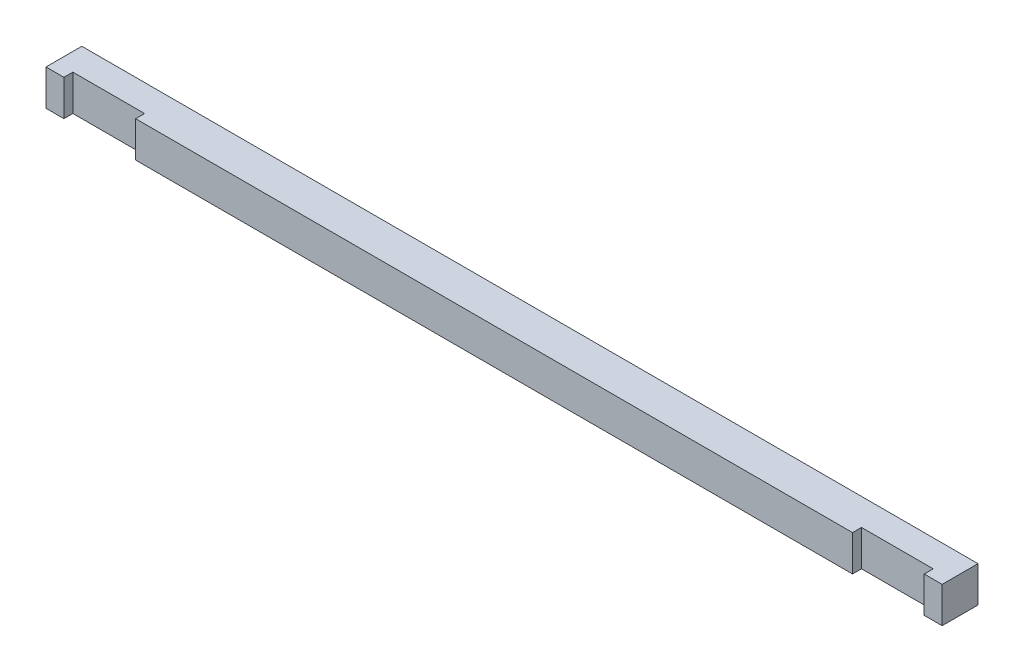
SolidWorks part; units mm, degrees
ref_plane "前视基准面" through (0, 0, 0) normal (0, 0, 1) x (1, 0, 0)
ref_plane "上视基准面" through (0, 0, 0) normal (0, 1, 0) x (1, 0, 0)
ref_plane "右视基准面" through (0, 0, 0) normal (1, 0, 0) x (0, 0, -1)
other "Configuration Table"
sketch "草图1" plane through (0, 0, 0) normal (0, 1, 0) x (1, 0, 0)
  line L0 (-125, 10) -> (125, 10)
  line L1 (0, 0) -> (0, 87.4961) construction
  line L2 (-125, 10) -> (-125, 0)
  line L3 (-125, 0) -> (-120, 0)
  line L4 (-120, 0) -> (-120, 2.5)
  line L5 (-120, 2.5) -> (-100, 2.5)
  line L6 (-100, 2.5) -> (-100, 0)
  line L7 (-100, 0) -> (100, 0)
  line L8 (125, 10) -> (125, 0)
  line L9 (0, 0) -> (19.2701, 0) construction
  line L10 (120, 0) -> (120, 2.5)
  line L11 (100, 2.5) -> (100, 0)
  line L12 (120, 2.5) -> (100, 2.5)
  line L13 (120, 0) -> (125, 0)
  dimension "D1" = 250
  dimension "D2" = 2.5
  dimension "D3" = 20
  dimension "D4" = 5
  dimension "D5" = 10
extrude "凸台-拉伸1" add sketch "草图1" along normal blind 10
